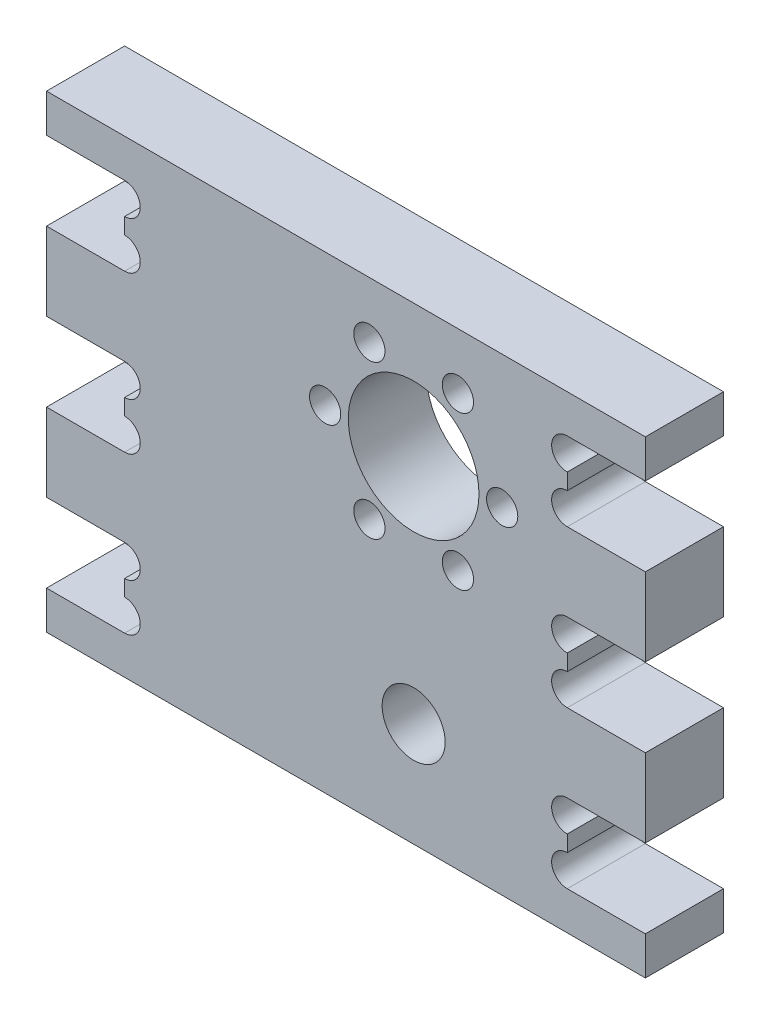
SolidWorks part; units mm, degrees
ref_plane "Ebene vorne" through (0, 0, 0) normal (0, 0, 1) x (1, 0, 0)
ref_plane "Ebene oben" through (0, 0, 0) normal (0, 1, 0) x (1, 0, 0)
ref_plane "Ebene rechts" through (0, 0, 0) normal (1, 0, 0) x (0, 0, -1)
sketch "Skizze1" plane through (0, 0, 0) normal (0, 0, 1) x (1, 0, 0)
  line L0 (15, 82.65) -> (0, 82.65)
  line L1 (0, 0) -> (115, 0)
  line L2 (15, 7.35) -> (0, 7.35)
  line L3 (0, 90) -> (115, 90)
  line L5 (0, 82.65) -> (0, 90)
  line L6 (15, 76.65) -> (15, 73.55)
  line L7 (15, 67.55) -> (0, 67.55)
  line L8 (0, 67.55) -> (0, 52.55)
  line L9 (0, 52.55) -> (15, 52.55)
  line L10 (15, 46.55) -> (15, 43.45)
  line L11 (15, 37.45) -> (0, 37.45)
  line L12 (0, 37.45) -> (0, 22.45)
  line L13 (0, 22.45) -> (15, 22.45)
  line L14 (15, 16.45) -> (15, 13.35)
  line L15 (0, 7.35) -> (0, 0)
  line L16 (115, 90) -> (115, 82.65)
  line L17 (115, 82.65) -> (100, 82.65)
  line L18 (100, 76.65) -> (100, 73.55)
  line L19 (100, 67.55) -> (115, 67.55)
  line L20 (115, 67.55) -> (115, 52.55)
  line L21 (115, 52.55) -> (100, 52.55)
  line L22 (100, 46.55) -> (100, 43.45)
  line L23 (100, 37.45) -> (115, 37.45)
  line L24 (115, 37.45) -> (115, 22.45)
  line L25 (115, 22.45) -> (100, 22.45)
  line L26 (100, 16.45) -> (100, 13.35)
  line L27 (100, 7.35) -> (115, 7.35)
  line L28 (115, 7.35) -> (115, 0)
  arc A0 (15, 82.65) -> (15, 76.65) centre (15, 79.65) cw
  arc A1 (15, 73.55) -> (15, 67.55) centre (15, 70.55) cw
  arc A2 (15, 52.55) -> (15, 46.55) centre (15, 49.55) cw
  arc A3 (15, 43.45) -> (15, 37.45) centre (15, 40.45) cw
  arc A4 (15, 22.45) -> (15, 16.45) centre (15, 19.45) cw
  arc A5 (15, 13.35) -> (15, 7.35) centre (15, 10.35) cw
  arc A6 (100, 82.65) -> (100, 76.65) centre (100, 79.65) ccw
  arc A7 (100, 73.55) -> (100, 67.55) centre (100, 70.55) ccw
  arc A8 (100, 52.55) -> (100, 46.55) centre (100, 49.55) ccw
  arc A9 (100, 43.45) -> (100, 37.45) centre (100, 40.45) ccw
  arc A10 (100, 22.45) -> (100, 16.45) centre (100, 19.45) ccw
  arc A11 (100, 13.35) -> (100, 7.35) centre (100, 10.35) ccw
  dimension "D13" = 6
  dimension "D14" = 6
  dimension "D1" = 115
  dimension "D2" = 90
  dimension "D3" = 15
  dimension "D4" = 6
  dimension "D5" = 6
  dimension "D6" = 6
  dimension "D7" = 6
  dimension "D8" = 6
  dimension "D9" = 6
  dimension "D11" = 15
  dimension "D12" = 15
  dimension "D19" = 15
  dimension "D20" = 15.1
  dimension "D21" = 15.1
  dimension "D22" = 15
  dimension "D23" = 15.1
  dimension "D24" = 7.35
extrude "outline" add sketch "Skizze1" along normal blind 15
sketch "Skizze2" plane through (0, 0, 15) normal (0, 0, 1) x (1, 0, 0)
  line L1 (0, 90) -> (115, 90) construction
  line L3 (115, 7.35) -> (115, 0) construction
  circle A31 centre (70.5, 64.5) radius 12.55
  circle A32 centre (70.5, 20) radius 6.05
  dimension "D38" = 25.1
  dimension "D39" = 12.1
  dimension "D1" = 44.5
  dimension "D2" = 44.5
  dimension "D5" = 25.5
extrude "inner" cut sketch "Skizze2" against normal blind 15
sketch "Skizze3" plane through (0, 0, 0) normal (0, 0, -1) x (-1, 0, 0)
  circle A0 centre (-79, 79.2224) radius 3
  circle A1 centre (-62, 79.2224) radius 3
  circle A2 centre (-53.5, 64.5) radius 3
  circle A3 centre (-62, 49.7776) radius 3
  circle A4 centre (-79, 49.7776) radius 3
  circle A5 centre (-87.5, 64.5) radius 3
  dimension "D1" = 6
  dimension "D2" = 6
  dimension "D3" = 6
  dimension "D4" = 6
  dimension "D5" = 6
  dimension "D6" = 6
extrude "holes" cut sketch "Skizze3" against normal blind 20
